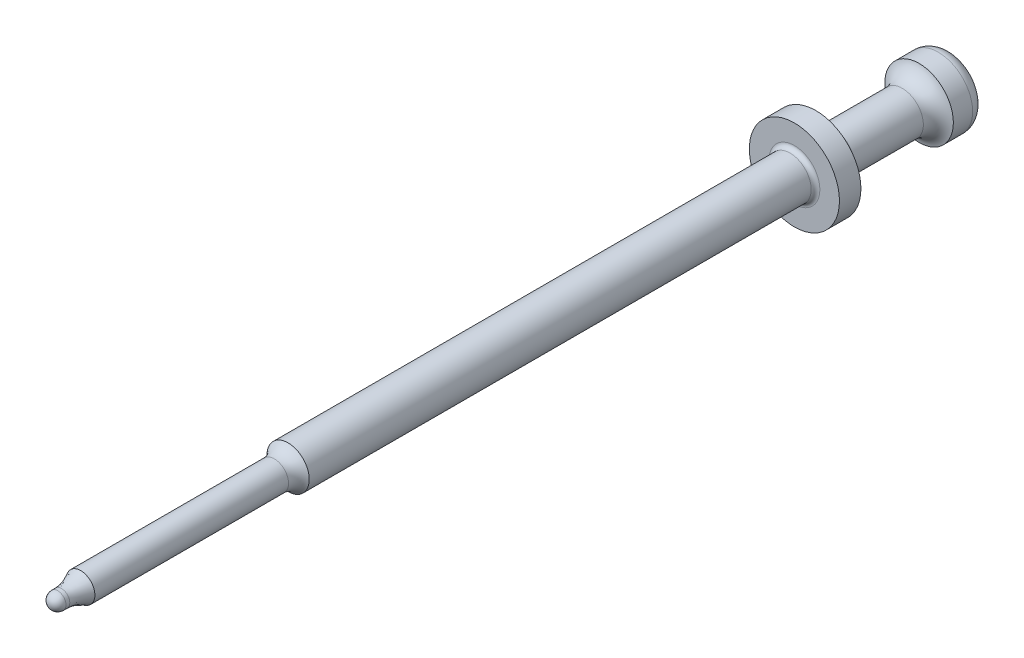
SolidWorks part; units mm, degrees
ref_plane "Front Plane" through (0, 0, 0) normal (0, 0, 1) x (1, 0, 0)
ref_plane "Top Plane" through (0, 0, 0) normal (0, 1, 0) x (1, 0, 0)
ref_plane "Right Plane" through (0, 0, 0) normal (1, 0, 0) x (0, 0, -1)
ref_plane "Plane1" through (0, 0, 82.15) normal (0, 0, 1) x (1, 0, 0)
sketch "Sketch1" plane through (0, 0, 0) normal (0, 0, 1) x (1, 0, 0)
  circle A0 centre (0, 0) radius 3.165
  dimension "D1" = 6.33
extrude "Boss-Extrude1" add sketch "Sketch1" along normal blind 2.98
sketch "Sketch2" plane through (0, 0, 2.98) normal (0, 0, 1) x (1, 0, 0)
  circle A0 centre (0, 0) radius 1.95
  dimension "D1" = 3.9
extrude "Boss-Extrude2" add sketch "Sketch2" along normal blind 9.53
sketch "Sketch3" plane through (0, 0, 12.51) normal (0, 0, 1) x (1, 0, 0)
  circle A0 centre (0, 0) radius 4.16
  dimension "D1" = 8.32
extrude "Boss-Extrude3" add sketch "Sketch3" along normal blind 1.98
sketch "Sketch4" plane through (0, 0, 14.49) normal (0, 0, 1) x (1, 0, 0)
  circle A0 centre (0, 0) radius 1.95
  dimension "D1" = 3.9
extrude "Boss-Extrude4" add sketch "Sketch4" along normal blind 46.74
sketch "Sketch5" plane through (0, 0, 61.23) normal (0, 0, 1) x (1, 0, 0)
  circle A0 centre (0, 0) radius 1.315
  dimension "D1" = 2.63
extrude "Boss-Extrude5" add sketch "Sketch5" along normal blind 19.15
sketch "Sketch6" plane through (0, 0, 82.15) normal (0, 0, 1) x (1, 0, 0)
  circle A0 centre (0, 0) radius 0.765
  dimension "D1" = 1.53
extrude "Boss-Extrude6" add sketch "Sketch6" along normal blind 0.35
sketch "Sketch7" plane through (0, 0, 82.5) normal (0, 0, 1) x (1, 0, 0)
  line L0 (0, 0.765) -> (0, -0.765)
  arc A0 (0, 0.765) -> (0, -0.765) centre (0, 0) ccw
  circle A1 centre (0, 0) radius 0.765 construction
revolve "Revolve1" add sketch "Sketch7" angle 180 about L0
loft "Loft1" add
fillet "Fillet1" radius 1.6 2 edges at (1.95, 0, 2.98) (1.95, 0, 12.51)
fillet "Fillet2" radius 1.2 1 edges at (3.165, 0, 0)
fillet "Fillet3" radius 0.4 1 edges at (1.95, 0, 14.49)
fillet "Fillet4" radius 1.6 1 edges at (1.315, 0, 61.23)
combine bodies "Combine1" operation type add bodies to combine 107 108
